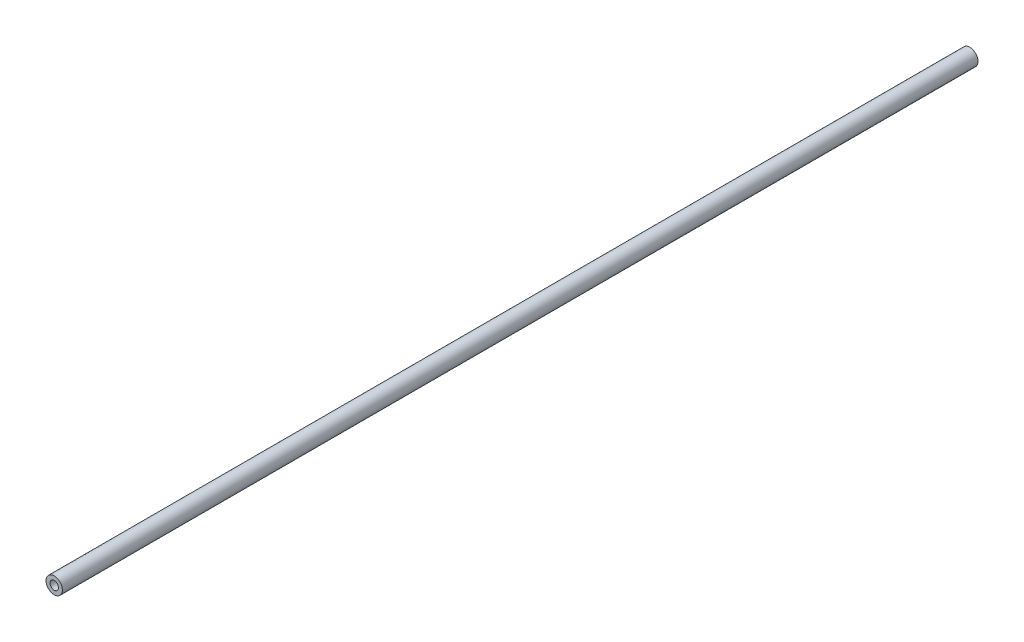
SolidWorks part; units mm, degrees
ref_plane "Front Plane" through (0, 0, 0) normal (0, 0, 1) x (1, 0, 0)
ref_plane "Top Plane" through (0, 0, 0) normal (0, 1, 0) x (1, 0, 0)
ref_plane "Right Plane" through (0, 0, 0) normal (1, 0, 0) x (0, 0, -1)
sketch "Sketch1" plane through (0, 0, 0) normal (0, 0, 1) x (1, 0, 0)
  circle A0 centre (0, 0) radius 5
  dimension "D1" = 10
extrude "Boss-Extrude1" add sketch "Sketch1" along normal blind 559
hole_wizard "#6 (0.204) Diameter Hole1" positions "Sketch2" profile "Sketch3" hole size "#6" standard "ANSI Inch"
sketch "Sketch2" plane through (0, 0, 0) normal (0, 0, -1) x (-1, 0, 0)
  point P0 (0, 0)
sketch "Sketch3" plane through (0, 0, 0) normal (1, 0, 0) x (0, 1, 0)
  line L0 (0, 0) -> (0, 31.5567)
  line L1 (0, 31.5567) -> (2.5908, 30)
  line L2 (2.5908, 30) -> (2.5908, 0)
  line L5 (2.5908, 0) -> (0, 0)
  line L10 (0, 31.5567) -> (-2.5908, 30) construction
  line L11 (0, -6.35) -> (0, 107.95) construction
  dimension "Hole Dia." = 5.1816
  dimension "Hole Depth" = 30
  dimension "Drill Angle" = 118
hole_wizard "#6 (0.204) Diameter Hole2" positions "Sketch4" profile "Sketch5" hole size "#6" standard "ANSI Inch"
sketch "Sketch4" plane through (0, 0, 559) normal (0, 0, 1) x (1, 0, 0)
  point P0 (0, 0)
sketch "Sketch5" plane through (0, 0, 559) normal (1, 0, 0) x (0, -1, 0)
  line L0 (0, 0) -> (0, 31.5567)
  line L1 (0, 31.5567) -> (2.5908, 30)
  line L2 (2.5908, 30) -> (2.5908, 0)
  line L5 (2.5908, 0) -> (0, 0)
  line L10 (0, 31.5567) -> (-2.5908, 30) construction
  line L11 (0, -6.35) -> (0, 107.95) construction
  dimension "Hole Dia." = 5.1816
  dimension "Hole Depth" = 30
  dimension "Drill Angle" = 118
